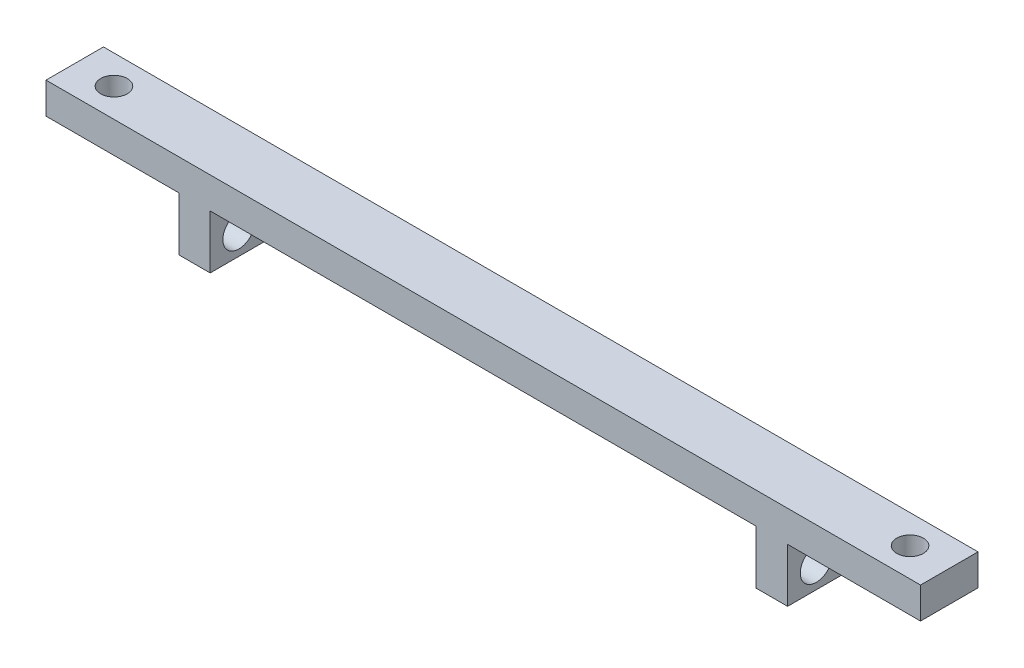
SolidWorks part; units mm, degrees
ref_plane "Front Plane" through (0, 0, 0) normal (0, 0, 1) x (1, 0, 0)
ref_plane "Top Plane" through (0, 0, 0) normal (0, 1, 0) x (1, 0, 0)
ref_plane "Right Plane" through (0, 0, 0) normal (1, 0, 0) x (0, 0, -1)
sketch "Sketch1" plane through (0, 0, 0) normal (0, 0, 1) x (1, 0, 0)
  line L1 (0, 0) -> (88.9, 0)
  line L2 (0, 0) -> (0, 8.636)
  line L3 (0, 8.636) -> (88.9, 8.636)
  line L4 (88.9, 0) -> (88.9, 8.636)
  dimension "D1" = 88.9
  dimension "D2" = 8.636
extrude "Extrude1" add sketch "Sketch1" against normal blind 5.842
sketch "Sketch2" plane through (0, 0, 0) normal (0, 0, 1) x (1, 0, 0)
  line L1 (0, 0) -> (88.9, 0) construction
  line L2 (0, 0) -> (13.5128, 0)
  line L3 (0, 0) -> (0, 5.461)
  line L4 (0, 5.461) -> (13.5128, 5.461)
  line L5 (13.5128, 0) -> (13.5128, 5.461)
  line L6 (16.6878, 0) -> (72.1868, 0)
  line L7 (16.6878, 0) -> (16.6878, 5.461)
  line L8 (16.6878, 5.461) -> (72.1868, 5.461)
  line L10 (72.1868, 0) -> (72.1868, 5.461)
  line L12 (75.3872, 0) -> (88.9, 0)
  line L13 (75.3872, 0) -> (75.3872, 5.461)
  line L14 (75.3872, 5.461) -> (88.9, 5.461)
  line L15 (88.9, 0) -> (88.9, 5.461)
  line L16 (88.9, 0) -> (88.9, 8.636) construction
  dimension "D1" = 5.461
  dimension "D2" = 55.499
  dimension "side_cut" = 13.5128
  dimension "D4" = 3.175
extrude "Extrude3" cut sketch "Sketch2" against normal blind 5.842
hole_wizard "#6-32 Tapped Hole1" positions "3DSketch1" profile "Sketch7" tap size "#6-32" standard "Ansi Inch"
sketch3d "3DSketch1"
  line L0 (0, 8.636, -5.842) -> (0, 8.636, 0) construction
  line L1 (88.9, 8.636, -5.842) -> (88.9, 8.636, 0) construction
  line L2 (0, 8.636, -2.921) -> (88.9, 8.636, -2.921) construction
  point P0 (3.9878, 8.636, -2.921)
  point P2 (84.9122, 8.636, -2.921)
  dimension "D1" = 3.9878
  dimension "D2" = 3.9878
sketch "Sketch7" plane through (3.9878, 8.636, -2.921) normal (1, 0, 0) x (0, 0, 1)
  line L0 (0, 0) -> (0, 8.636)
  line L1 (0, 8.636) -> (1.3525, 8.636)
  line L2 (1.3525, 8.636) -> (1.3525, 0)
  line L5 (1.3525, 0) -> (0, 0)
  line L11 (0, -6.35) -> (0, 107.95) construction
  dimension "Thru Tap Drill Dia." = 2.7051
  dimension "Thru Tap Drill Depth" = 8.636
hole_wizard "#30 (0.1285) Diameter Hole1" positions "3DSketch2" profile "Sketch10" hole size "#30" standard "Ansi Inch"
sketch3d "3DSketch2"
  line L5 (75.3872, 5.461, -2.921) -> (75.3872, 0, -2.921) construction
  line L6 (75.3872, 5.461, -5.842) -> (75.3872, 5.461, 0) construction
  line L7 (75.3872, 0, -5.842) -> (75.3872, 0, 0) construction
  point P0 (75.3872, 2.286, -2.921)
  dimension "D1" = 2.286
sketch "Sketch10" plane through (75.3872, 2.286, -2.921) normal (0, 1, 0) x (0, 0, -1)
  line L0 (0, 0) -> (0, 75.3872)
  line L1 (0, 75.3872) -> (1.6319, 75.3872)
  line L2 (1.6319, 75.3872) -> (1.6319, 0)
  line L5 (1.6319, 0) -> (0, 0)
  line L11 (0, -6.35) -> (0, 107.95) construction
  dimension "Thru Hole Dia." = 3.2639
  dimension "Thru Hole Depth" = 75.3872
